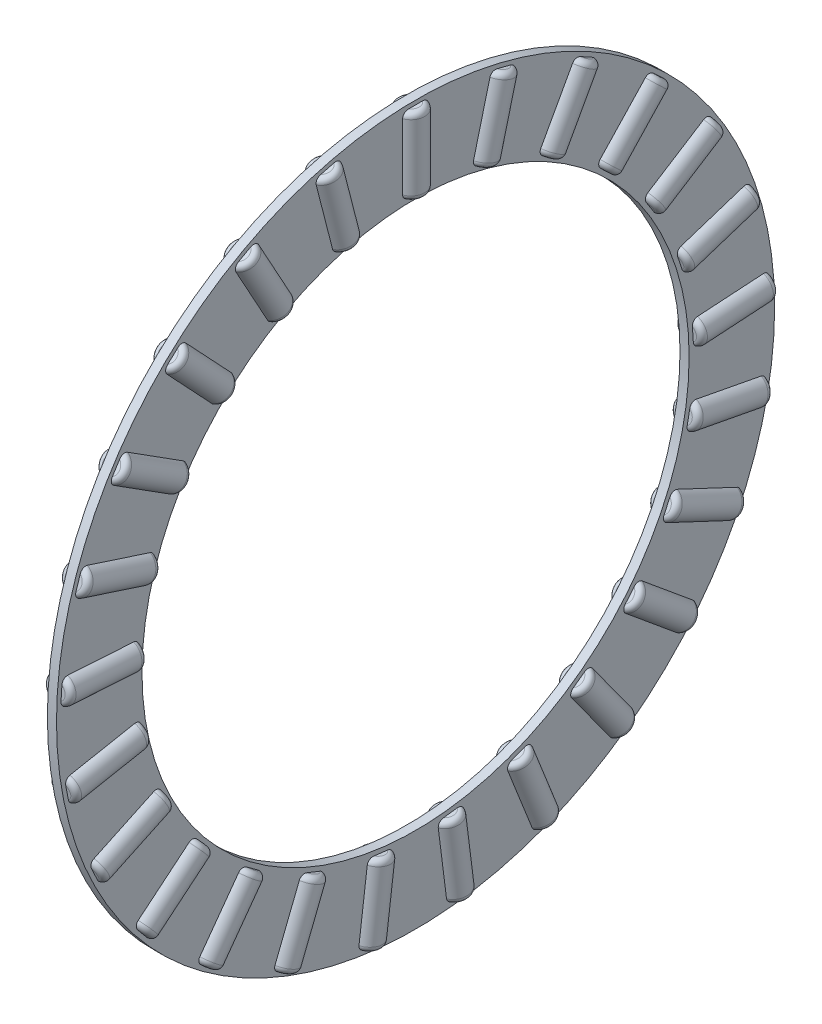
SolidWorks part; units mm, degrees
ref_plane "Plane1" through (0, 0, 0) normal (0, 0, 1) x (1, 0, 0)
ref_plane "Plane2" through (0, 0, 0) normal (0, 1, 0) x (1, 0, 0)
ref_plane "Plane3" through (0, 0, 0) normal (1, 0, 0) x (0, 0, -1)
sketch "Clipboard" plane through (0, 0, 0) normal (0, 0, 1) x (1, 0, 0)
  line L0 (-10, 0) -> (10, 0) construction
  line L1 (0, 0) -> (20.2657, -9.45)
  line L2 (0, 0) -> (41.9167, 19.5461)
  line L3 (0, 0) -> (20.2657, -9.45)
  line L4 (0, 0) -> (-22.3471, -0.7804)
sketch "CagSpiSke" plane through (0, 0, 0) normal (0, 0, 1) x (1, 0, 0)
  line L5 (-34.925, 0) -> (34.925, 0) construction
  line L6 (-0.6667, 52.5) -> (0.6667, 52.5)
  line L7 (-0.6667, 52.5) -> (-0.6667, 40)
  line L8 (-0.6667, 40) -> (0.6667, 40)
  line L9 (0.6667, 52.5) -> (0.6667, 40)
revolve "CageSpine" add sketch "CagSpiSke" angle 360 about L5
ref_axis "Axis1" through (-50, 0, 0) along (1, 0, 0)
sketch "RolDetSke" plane through (0, 0, 0) normal (0, 0, 1) x (1, 0, 0)
  line L0 (0, 33.02) -> (0, 55.88) construction
  line L3 (0, 51.875) -> (1.2, 51.875)
  line L4 (0, 51.875) -> (0, 40.625)
  line L5 (0, 40.625) -> (1.2, 40.625)
  line L6 (2, 51.075) -> (2, 41.425)
  arc A0 (2, 41.425) -> (1.2, 40.625) centre (1.2, 41.425) cw
  arc A1 (1.2, 51.875) -> (2, 51.075) centre (1.2, 51.075) cw
revolve "RollerDetailed" add sketch "RolDetSke" angle 360 about L0
pattern_circular "RollersDetailed" count 25 every 14.4 about axis through (-50, 0, 0) along (1, 0, 0) of "RollerDetailed"
sketch "RolSimSke" plane through (0, 0, 0) normal (0, 0, 1) x (1, 0, 0)
  line L1 (-17.78, 0) -> (12.7, 0) construction
  line L3 (-1.2, 51.875) -> (1.2, 51.875)
  line L4 (-2, 51.075) -> (-2, 41.425)
  line L5 (-1.2, 40.625) -> (1.2, 40.625)
  line L6 (2, 51.075) -> (2, 41.425)
  arc A0 (-2, 41.425) -> (-1.2, 40.625) centre (-1.2, 41.425) ccw
  arc A1 (-1.2, 51.875) -> (-2, 51.075) centre (-1.2, 51.075) ccw
  arc A2 (2, 51.075) -> (1.2, 51.875) centre (1.2, 51.075) ccw
  arc A3 (1.2, 40.625) -> (2, 41.425) centre (1.2, 41.425) ccw
revolve "RollersSimplified" [suppressed] add sketch "RolSimSke" angle 360 about L1
equation "\"BallCLRad@Clipboard\" =  ( \"OD@CagSpiSke\" + \"ID@CagSpiSke\" )  / 4"
equation "\"offset@RolSimSke\" = \"BallCLRad@Clipboard\" - \"Cyl_Len@RolSimSke\" / 2"
equation "\"offset@RolDetSke\" = \"BallCLRad@Clipboard\" - \"Cyl_Len@RolDetSke\" / 2"
equation "\"Thickness@CagSpiSke\" =  \"Roller_diameter@RolDetSke\"  / 3"
equation "\"HalfThick@CagSpiSke\" = \"Thickness@CagSpiSke\" / 2"
equation "\"radius@RolDetSke\" =  ( \"Roller_diameter@RolDetSke\" - \"Thickness@CagSpiSke\" )  * 0.6 / 2"
equation "\"Roller_diameter@RolSimSke\" = \"Roller_diameter@RolDetSke\""
equation "\"Cyl_Len@RolSimSke\" = \"Cyl_Len@RolDetSke\""
equation "\"Rol_rad@RolSimSke\" = \"radius@RolDetSke\""
equation "\"Halfdia@RolSimSke\" = \"Roller_diameter@RolSimSke\" / 2"
equation "\"Max_count@Clipboard\" = int( 3.14159265 / atn(( \"Roller_diameter@RolDetSke\" / 2) / sqr( \"offset@RolDetSke\"  *  \"offset@RolDetSke\" - ( \"Roller_diameter@RolDetSke\" / 2) *  ( \"Roller_diameter@RolDetSke\" "
equation "\"Max_count@Clipboard\" = ((sgn( \"Max_count@Clipboard\" - \"Count@Clipboard\" )-1)*( \"Max_count@Clipboard\" - \"Count@Clipboard\" ))/-2+ \"Count@Clipboard\""
equation "\"Count@RollersDetailed\" = int( \"Show_count@Clipboard\" ) "
equation "\"Count@RollersDetailed\" = ((sgn( \"Count@RollersDetailed\" - \"Max_count@Clipboard\" )-1)*( \"Count@RollersDetailed\" - \"Max_count@Clipboard\" ))/-2+ \"Max_count@Clipboard\""
equation "\"Count@RollersDetailed\" = ((sgn( \"Count@RollersDetailed\" - \"Min_count@Clipboard\" )+1)*( \"Count@RollersDetailed\" - \"Min_count@Clipboard\"))/2 +\"Min_count@Clipboard\""
equation "\"Angle@RollersDetailed\" = 360.0 / \"Max_count@Clipboard\""
